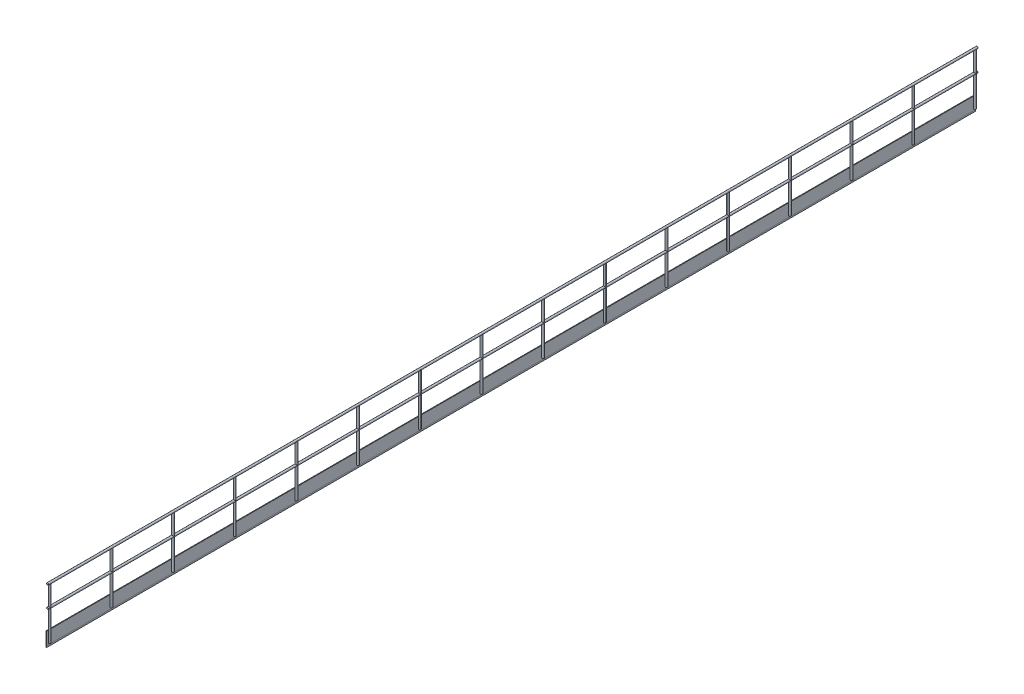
SolidWorks part; units mm, degrees
ref_plane "Vorne" through (0, 0, 0) normal (0, 0, 1) x (1, 0, 0)
ref_plane "Oben" through (0, 0, 0) normal (0, 1, 0) x (1, 0, 0)
ref_plane "Rechts" through (0, 0, 0) normal (1, 0, 0) x (0, 0, -1)
sketch "Skizze1" plane through (0, 0, 0) normal (0, 0, 1) x (1, 0, 0)
  line L1 (0, -50) -> (-150, -50)
  line L2 (0, -50) -> (0, 0)
  line L3 (0, 150) -> (-150, 150)
  line L4 (-150, -50) -> (-150, 150)
  line L5 (0, 0) -> (15, 0)
  line L6 (0, 150) -> (0, 300)
  line L7 (0, 300) -> (15, 300)
  line L8 (15, 0) -> (15, 300)
  dimension "D1" = 150
  dimension "D2" = 200
  dimension "D3" = 15
  dimension "D4" = 300
  dimension "D5" = 50
  dimension "D6" = 15
extrude "Linear austragen1" add sketch "Skizze1" along normal mid plane 22000
sketch "Skizze2" plane through (0, 0, 11000) normal (0, 0, 1) x (1, 0, 0)
  line L0 (15, 0) -> (15, 300) construction
  circle A0 centre (39.05, 1280) radius 24.05
  circle A1 centre (39.05, 780) radius 24.05
  dimension "D2" = 48.1
  dimension "D1" = 1280
  dimension "D3" = 500
extrude "Linear austragen2" add sketch "Skizze2" against normal up to surface (22000 mm away)
ref_plane "Ebene1" through (0, 50, 0) normal (0, -1, 0) x (1, 0, 0)
sketch "Skizze3" plane through (0, 50, 0) normal (0, -1, 0) x (1, 0, 0)
  line L0 (-150, 11000) -> (0, 11000) construction
  line L1 (15, 11000) -> (15, -11000) construction
  circle A0 centre (39.15, 10950) radius 24.15
  dimension "D1" = 48.3
  dimension "D2" = 50
extrude "Linear austragen6" add sketch "Skizze3" against normal blind 1230
mirror "Spiegeln1" about plane through (0, 0, 0) normal (0, 0, 1) of "Linear austragen6"
pattern_linear "Lineares Muster2" count 15 spacing 1460 along (0, 0, -1) of "Linear austragen6"
chamfer "Fase1" distance 150 angle 45 2 edges at (-150, 50, -11000) (-150, 50, 11000)
equation "\"Anzahl_Holme\"= \"L\"/1500"
equation "\"D3@Lineares Muster2\" = (\"L@Linear austragen1\"-100)/\"Anzahl_Holme\""
